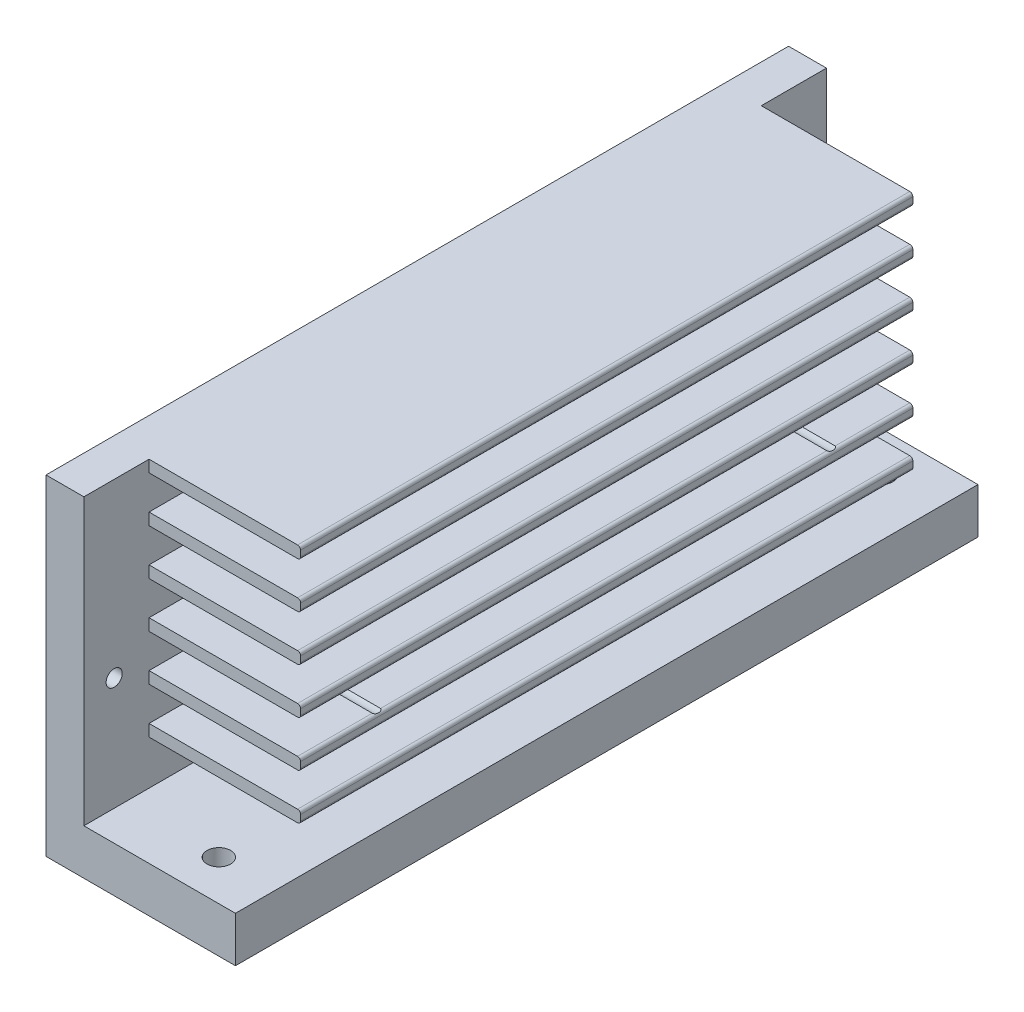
SolidWorks part; units mm, degrees
ref_plane "Front" through (0, 0, 0) normal (0, 0, 1) x (1, 0, 0)
ref_plane "Top" through (0, 0, 0) normal (0, 1, 0) x (1, 0, 0)
ref_plane "Right" through (0, 0, 0) normal (1, 0, 0) x (0, 0, -1)
sketch "Sketch1" plane through (0, 0, 0) normal (0, 0, 1) x (1, 0, 0)
  line L2 (0, 0) -> (0, 55.372)
  line L3 (0, 55.372) -> (6.35, 55.372)
  line L4 (6.35, 7.62) -> (6.35, 55.372)
  line L5 (0, 0) -> (31.75, 0)
  line L7 (6.35, 7.62) -> (31.75, 7.62)
  line L8 (31.75, 0) -> (31.75, 7.62)
  dimension "D1" = 7.62
  dimension "D2" = 31.75
  dimension "D3" = 55.372
  dimension "D4" = 6.35
extrude "Extrude1" add sketch "Sketch1" along normal mid plane 124.46
sketch "Sketch2" plane through (0, 0, 62.23) normal (0, 0, 1) x (1, 0, 0)
  line L0 (6.35, 55.372) -> (0, 55.372) construction
  line L1 (6.35, 55.372) -> (31.242, 55.372)
  line L2 (6.35, 55.372) -> (6.35, 53.3908)
  line L3 (6.35, 53.3908) -> (31.242, 53.3908)
  line L4 (31.75, 54.864) -> (31.75, 53.8988)
  arc A0 (31.242, 55.372) -> (31.75, 54.864) centre (31.242, 54.864) cw
  arc A1 (31.242, 53.3908) -> (31.75, 53.8988) centre (31.242, 53.8988) ccw
  dimension "D3" = 0.508
  dimension "D4" = 1.9812
  dimension "D5" = 25.4
extrude "Extrude2" add sketch "Sketch2" against normal up to surface (124.46 mm away)
pattern_linear "LPattern1" count 6 spacing 7.6708 along (0, -1, 0) of "Extrude2"
sketch "Sketch5" plane through (0, 0, 0) normal (0, -1, 0) x (1, 0, 0)
  line L0 (0, 0) -> (22.225, 0) construction
  line L1 (22.225, -55.4848) -> (22.225, 55.4848) construction
  line L3 (0, 62.23) -> (0, -62.23) construction
  circle A0 centre (22.225, 55.4848) radius 1.9812
  circle A1 centre (22.225, -55.4848) radius 1.9812
  point P5 (22.225, 0)
  dimension "D2" = 3.9624
  dimension "D3" = 3.9624
  dimension "D4" = 110.9696
  dimension "D1" = 22.225
extrude "Cut-Extrude1" cut sketch "Sketch5" against normal up to next
hole_wizard "#6-32 Tapped Hole1" positions "Sketch10" profile "Sketch9" tap size "#6-32" standard "Ansi Inch"
sketch "Sketch10" plane through (0, 0, 0) normal (-1, 0, 0) x (0, 0, 1)
  line L0 (-57.15, 26.543) -> (57.15, 26.543) construction
  line L1 (0, 0) -> (0, 26.543) construction
  line L2 (62.23, 0) -> (-62.23, 0) construction
  point P0 (-57.15, 26.543)
  point P1 (57.15, 26.543)
  dimension "D1" = 114.3
  dimension "D2" = 26.543
sketch "Sketch9" plane through (0, 26.543, -57.15) normal (0, 1, 0) x (0, 0, 1)
  line L0 (0, 0) -> (0, 31.75)
  line L1 (0, 31.75) -> (1.3525, 31.75)
  line L2 (1.3525, 31.75) -> (1.3525, 0)
  line L5 (1.3525, 0) -> (0, 0)
  line L11 (0, -6.35) -> (0, 107.95) construction
  dimension "Thru Tap Drill Dia." = 2.7051
  dimension "Thru Tap Drill Depth" = 31.75
sketch "Sketch6" plane through (6.35, 0, 0) normal (1, 0, 0) x (0, 0, -1)
  line L0 (-62.23, 7.62) -> (62.23, 7.62) construction
  line L1 (62.23, 7.62) -> (51.308, 7.62)
  line L2 (62.23, 7.62) -> (62.23, 55.372)
  line L3 (62.23, 55.372) -> (51.308, 55.372)
  line L4 (51.308, 7.62) -> (51.308, 55.372)
  line L5 (-62.23, 7.62) -> (-51.308, 7.62)
  line L6 (-62.23, 7.62) -> (-62.23, 55.372)
  line L7 (-62.23, 55.372) -> (-51.308, 55.372)
  line L8 (-51.308, 7.62) -> (-51.308, 55.372)
  dimension "D2" = 10.922
  dimension "D4" = 10.922
extrude "Cut-Extrude3" cut sketch "Sketch6" along normal through all
sketch "Sketch7" plane through (0, 0, 0) normal (-1, 0, 0) x (0, 0, 1)
  line L0 (57.15, 26.543) -> (-57.15, 26.543) construction
  circle A0 centre (-38.1, 26.543) radius 2.3749
  circle A1 centre (38.1, 26.543) radius 2.3749
  circle A3 centre (-57.15, 26.543) radius 1.3525 construction
  circle A5 centre (57.15, 26.543) radius 1.3525 construction
  dimension "D3" = 4.7498
  dimension "D4" = 4.7498
  dimension "D1" = 19.05
  dimension "D2" = 19.05
hole_wizard "CSK for #6 Flat Head Machine Screw1" positions "3DSketch1" profile "Sketch8" countersink size "#6" standard "Ansi Inch"
sketch3d "3DSketch1"
  point P0 (0, 26.543, -38.1)
  point P3 (0, 26.543, 38.1)
sketch "Sketch8" plane through (0, 26.543, -38.1) normal (0, 1, 0) x (0, 0, 1)
  line L0 (0, 0) -> (0, 31.75)
  line L1 (0, 31.75) -> (1.9812, 31.75)
  line L2 (1.9812, 31.75) -> (1.9812, 2.813)
  line L3 (1.9812, 2.813) -> (4.4265, 0)
  line L5 (4.4265, 0) -> (0, 0)
  line L6 (-1.9812, 2.813) -> (-4.4265, 0) construction
  line L11 (0, -6.35) -> (0, 107.95) construction
  dimension "Thru Hole Dia." = 3.9624
  dimension "Thru Hole Depth" = 31.75
  dimension "Near C'Sink Dia." = 8.853
  dimension "Near C'Sink Angle" = 82
